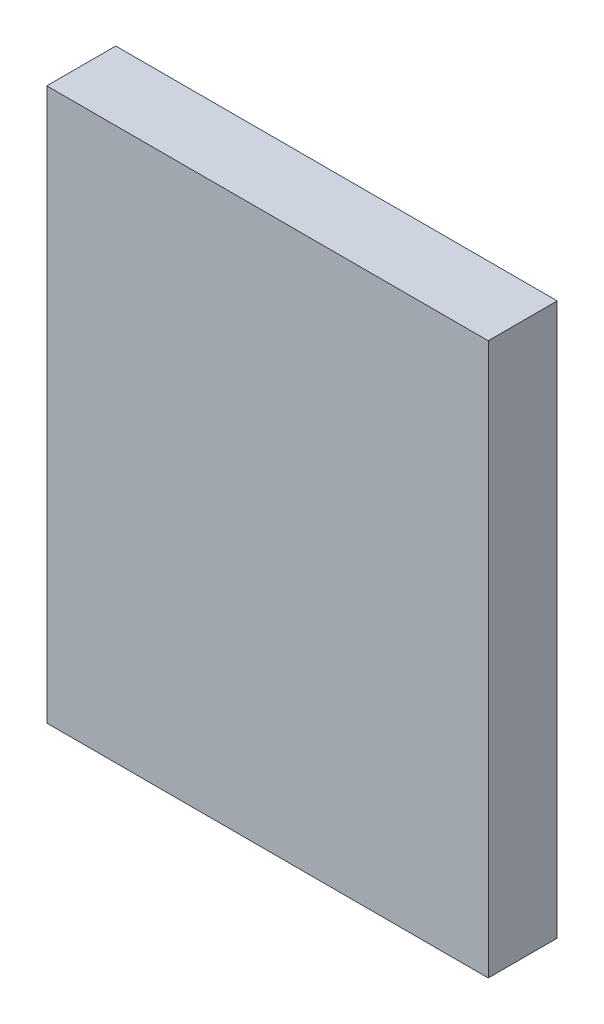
SolidWorks part; units mm, degrees
ref_plane "Front Plane" through (0, 0, 0) normal (0, 0, 1) x (1, 0, 0)
ref_plane "Top Plane" through (0, 0, 0) normal (0, 1, 0) x (1, 0, 0)
ref_plane "Right Plane" through (0, 0, 0) normal (1, 0, 0) x (0, 0, -1)
sketch "Sketch1" plane through (0, 0, 0) normal (0, 0, 1) x (1, 0, 0)
  line L1 (0, 0) -> (80, 0)
  line L2 (0, 0) -> (0, 100)
  line L3 (0, 100) -> (80, 100)
  line L4 (80, 0) -> (80, 100)
  dimension "D1" = 80
  dimension "D2" = 100
extrude "Extrude1" add sketch "Sketch1" along normal blind 12.5
